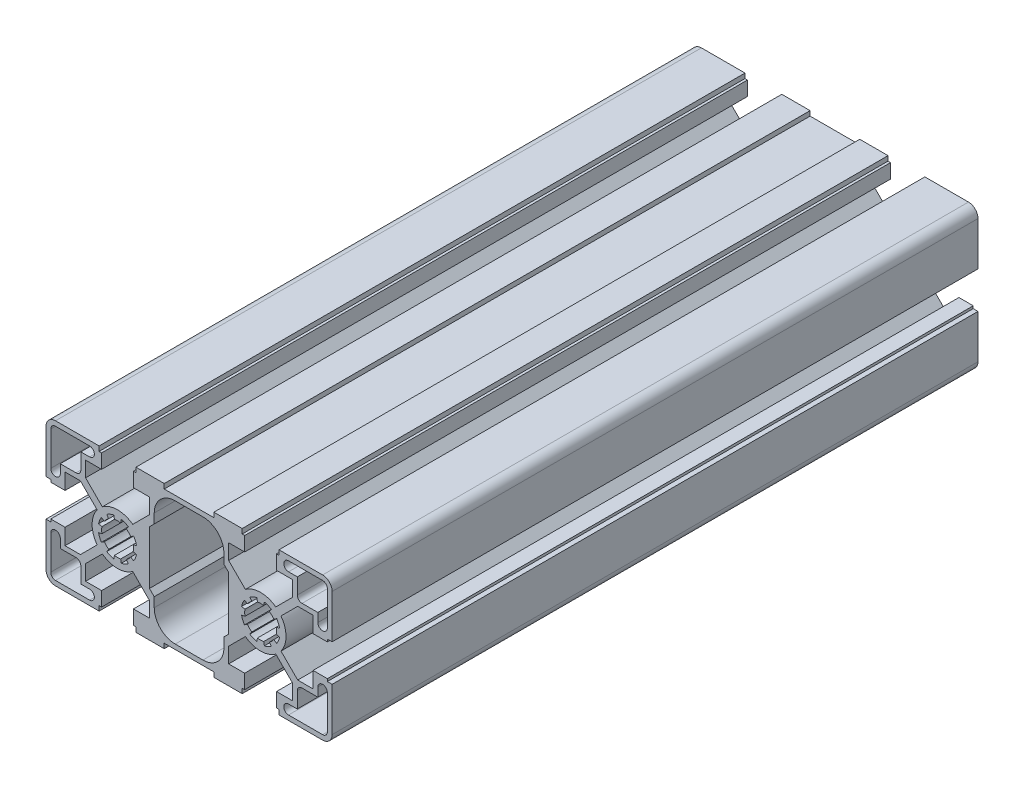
SolidWorks part; units mm, degrees
ref_plane "Front Plane" through (0, 0, 0) normal (0, 0, 1) x (1, 0, 0)
ref_plane "Top Plane" through (0, 0, 0) normal (0, 1, 0) x (1, 0, 0)
ref_plane "Right Plane" through (0, 0, 0) normal (1, 0, 0) x (0, 0, -1)
sketch "Sketch1" plane through (0, 0, 0) normal (0, 0, 1) x (1, 0, 0)
  line L0 (-27.5082, 0) -> (-17.5006, 0) construction
  line L1 (17.5006, 0) -> (27.5082, 0) construction
  line L2 (-42.0116, 22.5044) -> (-28.2956, 22.5044)
  line L3 (-28.2956, 22.5044) -> (-28.2956, 21.0058)
  line L4 (-28.2956, 21.0058) -> (-27.5082, 21.0058)
  line L5 (22.5044, -5.0038) -> (22.5044, 5.0038) construction
  line L6 (-27.5082, 21.0058) -> (-27.5082, 16.51)
  line L7 (-27.5082, 16.51) -> (-32.5501, 16.51)
  line L8 (-32.5501, 16.51) -> (-32.5501, 11.6801)
  line L9 (-32.5501, 11.6801) -> (-27.2854, 6.4154)
  line L11 (-34.1845, 10.0457) -> (-28.9198, 4.781)
  line L12 (-39.0144, 10.0457) -> (-34.1845, 10.0457)
  line L13 (-39.0144, 5.0038) -> (-39.0144, 10.0457)
  line L14 (-43.5102, 5.0038) -> (-39.0144, 5.0038)
  line L15 (-43.5102, 5.7912) -> (-43.5102, 5.0038)
  line L16 (-45.0088, 5.7912) -> (-43.5102, 5.7912)
  line L17 (-45.0088, 19.5072) -> (-45.0088, 5.7912)
  line L18 (-40.513, 11.5443) -> (-35.5473, 11.5443)
  line L19 (-40.513, 11.5443) -> (-40.513, 8.7884)
  line L20 (-34.0487, 18.0086) -> (-34.0487, 13.0429)
  line L21 (-43.5102, 19.5072) -> (-43.5102, 8.7884)
  line L23 (-34.0487, 18.0086) -> (-31.2928, 18.0086)
  line L24 (-42.0116, 21.0058) -> (-31.2928, 21.0058)
  line L25 (-21.3151, 5.9789) -> (-21.5282, 4.9077)
  line L26 (-23.6937, 5.9789) -> (-23.4806, 4.9077)
  line L27 (-17.4358, 3.3868) -> (-18.3439, 2.78)
  line L28 (-19.1176, 5.0686) -> (-19.7244, 4.1605)
  line L29 (-16.5255, -1.1893) -> (-17.5967, -0.9762)
  line L30 (-16.5255, 1.1893) -> (-17.5967, 0.9762)
  line L31 (-19.1176, -5.0686) -> (-19.7244, -4.1605)
  line L32 (-17.4358, -3.3868) -> (-18.3439, -2.78)
  line L33 (-23.6937, -5.9789) -> (-23.4806, -4.9077)
  line L34 (-21.3151, -5.9789) -> (-21.5282, -4.9077)
  line L35 (-27.573, -3.3868) -> (-26.6649, -2.78)
  line L36 (-25.8912, -5.0686) -> (-25.2844, -4.1605)
  line L37 (-28.4833, 1.1893) -> (-27.4121, 0.9762)
  line L38 (-28.4833, -1.1893) -> (-27.4121, -0.9762)
  line L39 (-25.8912, 5.0686) -> (-25.2844, 4.1605)
  line L40 (-27.573, 3.3868) -> (-26.6649, 2.78)
  line L41 (-7.8105, 22.5044) -> (-7.8105, 21.0058)
  line L42 (-7.8105, 21.0058) -> (7.8105, 21.0058)
  line L43 (-7.8105, 22.5044) -> (-16.7132, 22.5044)
  line L44 (-16.7132, 22.5044) -> (-16.7132, 21.0058)
  line L45 (-16.7132, 21.0058) -> (-17.5006, 21.0058)
  line L46 (-17.5006, 21.0058) -> (-17.5006, 16.51)
  line L47 (-17.5006, 16.51) -> (-12.4587, 16.51)
  line L48 (-12.4587, 16.51) -> (-12.4587, 11.6801)
  line L49 (-12.4587, 11.6801) -> (-17.7234, 6.4154)
  line L50 (-10.9601, 9.9099) -> (-12.4587, 8.4113)
  line L51 (7.8105, 21.0058) -> (7.8105, 22.5044)
  line L53 (-7.8105, -22.5044) -> (-16.7132, -22.5044)
  line L54 (7.8105, -22.5044) -> (16.7132, -22.5044)
  line L55 (7.8105, -21.0058) -> (7.8105, -22.5044)
  line L56 (-7.8105, -21.0058) -> (7.8105, -21.0058)
  line L57 (-7.8105, -22.5044) -> (-7.8105, -21.0058)
  line L58 (-40.513, -11.5443) -> (-35.5473, -11.5443)
  line L59 (4.3561, 19.5072) -> (-4.3561, 19.5072)
  line L60 (-10.9601, 12.9032) -> (-10.9601, 9.9099)
  line L61 (-12.4587, -8.4113) -> (-10.9601, -9.9099)
  line L62 (-12.4587, 8.4113) -> (-12.4587, -8.4113)
  line L63 (-10.9601, -12.9032) -> (-10.9601, -9.9099)
  line L64 (4.3561, -19.5072) -> (-4.3561, -19.5072)
  line L65 (10.9601, 12.9032) -> (10.9601, 9.9099)
  line L66 (10.9601, -12.9032) -> (10.9601, -9.9099)
  line L67 (12.4587, 8.4113) -> (12.4587, -8.4113)
  line L68 (10.9601, -9.9099) -> (12.4587, -8.4113)
  line L69 (10.9601, 9.9099) -> (12.4587, 8.4113)
  line L70 (-12.4587, -11.6801) -> (-17.7234, -6.4154)
  line L71 (-12.4587, -16.51) -> (-12.4587, -11.6801)
  line L72 (-17.5006, -16.51) -> (-12.4587, -16.51)
  line L73 (-17.5006, -21.0058) -> (-17.5006, -16.51)
  line L74 (-16.7132, -21.0058) -> (-17.5006, -21.0058)
  line L75 (-16.7132, -22.5044) -> (-16.7132, -21.0058)
  line L76 (-34.0487, -18.0086) -> (-31.2928, -18.0086)
  line L77 (-42.0116, -21.0058) -> (-31.2928, -21.0058)
  line L78 (-42.0116, -22.5044) -> (-28.2956, -22.5044)
  line L79 (-28.2956, -22.5044) -> (-28.2956, -21.0058)
  line L80 (-28.2956, -21.0058) -> (-27.5082, -21.0058)
  line L81 (-27.5082, -21.0058) -> (-27.5082, -16.51)
  line L82 (-27.5082, -16.51) -> (-32.5501, -16.51)
  line L83 (-32.5501, -16.51) -> (-32.5501, -11.6801)
  line L84 (-32.5501, -11.6801) -> (-27.2854, -6.4154)
  line L85 (-34.1845, -10.0457) -> (-28.9198, -4.781)
  line L86 (-43.5102, -19.5072) -> (-43.5102, -8.7884)
  line L87 (-34.0487, -18.0086) -> (-34.0487, -13.0429)
  line L88 (-40.513, -11.5443) -> (-40.513, -8.7884)
  line L89 (-45.0088, -19.5072) -> (-45.0088, -5.7912)
  line L90 (-45.0088, -5.7912) -> (-43.5102, -5.7912)
  line L91 (-43.5102, -5.7912) -> (-43.5102, -5.0038)
  line L92 (-43.5102, -5.0038) -> (-39.0144, -5.0038)
  line L93 (-39.0144, -5.0038) -> (-39.0144, -10.0457)
  line L94 (-39.0144, -10.0457) -> (-34.1845, -10.0457)
  line L96 (42.0116, 21.0058) -> (31.2928, 21.0058)
  line L97 (42.0116, 22.5044) -> (28.2956, 22.5044)
  line L98 (34.0487, 18.0086) -> (31.2928, 18.0086)
  line L99 (27.5082, 21.0058) -> (27.5082, 16.51)
  line L100 (28.2956, 21.0058) -> (27.5082, 21.0058)
  line L101 (28.2956, 22.5044) -> (28.2956, 21.0058)
  line L102 (17.5006, 21.0058) -> (17.5006, 16.51)
  line L103 (16.7132, 21.0058) -> (17.5006, 21.0058)
  line L104 (16.7132, 22.5044) -> (16.7132, 21.0058)
  line L105 (7.8105, 22.5044) -> (16.7132, 22.5044)
  line L106 (39.0144, -10.0457) -> (34.1845, -10.0457)
  line L107 (39.0144, -5.0038) -> (39.0144, -10.0457)
  line L108 (43.5102, -5.0038) -> (39.0144, -5.0038)
  line L109 (43.5102, -5.7912) -> (43.5102, -5.0038)
  line L110 (45.0088, -5.7912) -> (43.5102, -5.7912)
  line L111 (45.0088, -19.5072) -> (45.0088, -5.7912)
  line L112 (40.513, -11.5443) -> (35.5473, -11.5443)
  line L113 (40.513, -11.5443) -> (40.513, -8.7884)
  line L114 (34.0487, -18.0086) -> (34.0487, -13.0429)
  line L115 (43.5102, -19.5072) -> (43.5102, -8.7884)
  line L116 (34.1845, -10.0457) -> (28.9198, -4.781)
  line L117 (32.5501, -11.6801) -> (27.2854, -6.4154)
  line L118 (32.5501, -16.51) -> (32.5501, -11.6801)
  line L119 (27.5082, -16.51) -> (32.5501, -16.51)
  line L120 (27.5082, -21.0058) -> (27.5082, -16.51)
  line L121 (28.2956, -21.0058) -> (27.5082, -21.0058)
  line L122 (28.2956, -22.5044) -> (28.2956, -21.0058)
  line L123 (42.0116, -22.5044) -> (28.2956, -22.5044)
  line L124 (42.0116, -21.0058) -> (31.2928, -21.0058)
  line L125 (34.0487, -18.0086) -> (31.2928, -18.0086)
  line L126 (16.7132, -22.5044) -> (16.7132, -21.0058)
  line L127 (16.7132, -21.0058) -> (17.5006, -21.0058)
  line L128 (17.5006, -21.0058) -> (17.5006, -16.51)
  line L129 (17.5006, -16.51) -> (12.4587, -16.51)
  line L130 (12.4587, -16.51) -> (12.4587, -11.6801)
  line L131 (12.4587, -11.6801) -> (17.7234, -6.4154)
  line L132 (12.4587, 11.6801) -> (17.7234, 6.4154)
  line L133 (12.4587, 16.51) -> (12.4587, 11.6801)
  line L134 (27.573, 3.3868) -> (26.6649, 2.78)
  line L135 (25.8912, 5.0686) -> (25.2844, 4.1605)
  line L136 (28.4833, -1.1893) -> (27.4121, -0.9762)
  line L137 (28.4833, 1.1893) -> (27.4121, 0.9762)
  line L138 (25.8912, -5.0686) -> (25.2844, -4.1605)
  line L139 (27.573, -3.3868) -> (26.6649, -2.78)
  line L140 (21.3151, -5.9789) -> (21.5282, -4.9077)
  line L141 (23.6937, -5.9789) -> (23.4806, -4.9077)
  line L142 (17.4358, -3.3868) -> (18.3439, -2.78)
  line L143 (19.1176, -5.0686) -> (19.7244, -4.1605)
  line L144 (16.5255, 1.1893) -> (17.5967, 0.9762)
  line L145 (16.5255, -1.1893) -> (17.5967, -0.9762)
  line L146 (19.1176, 5.0686) -> (19.7244, 4.1605)
  line L147 (17.4358, 3.3868) -> (18.3439, 2.78)
  line L148 (23.6937, 5.9789) -> (23.4806, 4.9077)
  line L149 (21.3151, 5.9789) -> (21.5282, 4.9077)
  line L150 (43.5102, 19.5072) -> (43.5102, 8.7884)
  line L151 (34.0487, 18.0086) -> (34.0487, 13.0429)
  line L152 (40.513, 11.5443) -> (40.513, 8.7884)
  line L153 (40.513, 11.5443) -> (35.5473, 11.5443)
  line L154 (45.0088, 19.5072) -> (45.0088, 5.7912)
  line L155 (45.0088, 5.7912) -> (43.5102, 5.7912)
  line L156 (43.5102, 5.7912) -> (43.5102, 5.0038)
  line L157 (43.5102, 5.0038) -> (39.0144, 5.0038)
  line L158 (39.0144, 5.0038) -> (39.0144, 10.0457)
  line L159 (39.0144, 10.0457) -> (34.1845, 10.0457)
  line L160 (34.1845, 10.0457) -> (28.9198, 4.781)
  line L161 (32.5501, 11.6801) -> (27.2854, 6.4154)
  line L162 (32.5501, 16.51) -> (32.5501, 11.6801)
  line L163 (12.4587, 16.51) -> (17.5006, 16.51)
  line L164 (27.5082, 16.51) -> (32.5501, 16.51)
  arc A0 (-45.0088, 19.5072) -> (-42.0116, 22.5044) centre (-42.0116, 19.5072) cw
  arc A1 (-43.5102, 8.7884) -> (-40.513, 8.7884) centre (-42.0116, 8.7884) ccw
  arc A2 (-43.5102, 19.5072) -> (-42.0116, 21.0058) centre (-42.0116, 19.5072) cw
  arc A3 (-31.2928, 21.0058) -> (-31.2928, 18.0086) centre (-31.2928, 19.5072) cw
  arc A4 (-34.0487, 13.0429) -> (-35.5473, 11.5443) centre (-35.5473, 13.0429) cw
  arc A6 (-21.5282, 4.9077) -> (-23.4806, 4.9077) centre (-22.5044, 0) ccw
  arc A7 (-27.573, 3.3868) -> (-28.4833, 1.1893) centre (-22.5044, 0) ccw
  arc A8 (-18.3439, 2.78) -> (-19.7244, 4.1605) centre (-22.5044, 0) ccw
  arc A9 (-17.5967, -0.9762) -> (-17.5967, 0.9762) centre (-22.5044, 0) ccw
  arc A10 (-19.7244, -4.1605) -> (-18.3439, -2.78) centre (-22.5044, 0) ccw
  arc A11 (-23.4806, -4.9077) -> (-21.5282, -4.9077) centre (-22.5044, 0) ccw
  arc A12 (-26.6649, -2.78) -> (-25.2844, -4.1605) centre (-22.5044, 0) ccw
  arc A13 (-27.4121, 0.9762) -> (-27.4121, -0.9762) centre (-22.5044, 0) ccw
  arc A14 (-25.2844, 4.1605) -> (-26.6649, 2.78) centre (-22.5044, 0) ccw
  arc A15 (-28.4833, -1.1893) -> (-27.573, -3.3868) centre (-22.5044, 0) ccw
  arc A16 (-25.8912, -5.0686) -> (-23.6937, -5.9789) centre (-22.5044, 0) ccw
  arc A17 (-21.3151, -5.9789) -> (-19.1176, -5.0686) centre (-22.5044, 0) ccw
  arc A18 (-17.4358, -3.3868) -> (-16.5255, -1.1893) centre (-22.5044, 0) ccw
  arc A19 (-16.5255, 1.1893) -> (-17.4358, 3.3868) centre (-22.5044, 0) ccw
  arc A20 (-19.1176, 5.0686) -> (-21.3151, 5.9789) centre (-22.5044, 0) ccw
  arc A21 (-23.6937, 5.9789) -> (-25.8912, 5.0686) centre (-22.5044, 0) ccw
  arc A22 (-34.0487, -13.0429) -> (-35.5473, -11.5443) centre (-35.5473, -13.0429) ccw
  arc A23 (-4.3561, 19.5072) -> (-10.9601, 12.9032) centre (-4.3561, 12.9032) ccw
  arc A24 (-4.3561, -19.5072) -> (-10.9601, -12.9032) centre (-4.3561, -12.9032) cw
  arc A25 (4.3561, 19.5072) -> (10.9601, 12.9032) centre (4.3561, 12.9032) cw
  arc A26 (4.3561, -19.5072) -> (10.9601, -12.9032) centre (4.3561, -12.9032) ccw
  arc A27 (-31.2928, -21.0058) -> (-31.2928, -18.0086) centre (-31.2928, -19.5072) ccw
  arc A28 (-43.5102, -19.5072) -> (-42.0116, -21.0058) centre (-42.0116, -19.5072) ccw
  arc A29 (-45.0088, -19.5072) -> (-42.0116, -22.5044) centre (-42.0116, -19.5072) ccw
  arc A30 (-43.5102, -8.7884) -> (-40.513, -8.7884) centre (-42.0116, -8.7884) cw
  arc A31 (-17.7234, 6.4154) -> (-27.2854, 6.4154) centre (-22.5044, 0) ccw
  arc A32 (-27.2854, -6.4154) -> (-17.7234, -6.4154) centre (-22.5044, 0) ccw
  arc A33 (-28.9198, 4.781) -> (-28.9198, -4.781) centre (-22.5044, 0) ccw
  arc A34 (45.0088, 19.5072) -> (42.0116, 22.5044) centre (42.0116, 19.5072) ccw
  arc A35 (43.5102, 19.5072) -> (42.0116, 21.0058) centre (42.0116, 19.5072) ccw
  arc A36 (31.2928, 21.0058) -> (31.2928, 18.0086) centre (31.2928, 19.5072) ccw
  arc A37 (28.9198, 4.781) -> (28.9198, -4.781) centre (22.5044, 0) cw
  arc A38 (27.2854, -6.4154) -> (17.7234, -6.4154) centre (22.5044, 0) cw
  arc A39 (17.7234, 6.4154) -> (27.2854, 6.4154) centre (22.5044, 0) cw
  arc A40 (43.5102, -8.7884) -> (40.513, -8.7884) centre (42.0116, -8.7884) ccw
  arc A41 (34.0487, -13.0429) -> (35.5473, -11.5443) centre (35.5473, -13.0429) cw
  arc A42 (45.0088, -19.5072) -> (42.0116, -22.5044) centre (42.0116, -19.5072) cw
  arc A43 (43.5102, -19.5072) -> (42.0116, -21.0058) centre (42.0116, -19.5072) cw
  arc A44 (31.2928, -21.0058) -> (31.2928, -18.0086) centre (31.2928, -19.5072) cw
  arc A45 (23.6937, 5.9789) -> (25.8912, 5.0686) centre (22.5044, 0) cw
  arc A46 (19.1176, 5.0686) -> (21.3151, 5.9789) centre (22.5044, 0) cw
  arc A47 (16.5255, 1.1893) -> (17.4358, 3.3868) centre (22.5044, 0) cw
  arc A48 (17.4358, -3.3868) -> (16.5255, -1.1893) centre (22.5044, 0) cw
  arc A49 (21.3151, -5.9789) -> (19.1176, -5.0686) centre (22.5044, 0) cw
  arc A50 (25.8912, -5.0686) -> (23.6937, -5.9789) centre (22.5044, 0) cw
  arc A51 (28.4833, -1.1893) -> (27.573, -3.3868) centre (22.5044, 0) cw
  arc A52 (25.2844, 4.1605) -> (26.6649, 2.78) centre (22.5044, 0) cw
  arc A53 (27.4121, 0.9762) -> (27.4121, -0.9762) centre (22.5044, 0) cw
  arc A54 (26.6649, -2.78) -> (25.2844, -4.1605) centre (22.5044, 0) cw
  arc A55 (23.4806, -4.9077) -> (21.5282, -4.9077) centre (22.5044, 0) cw
  arc A56 (19.7244, -4.1605) -> (18.3439, -2.78) centre (22.5044, 0) cw
  arc A57 (17.5967, -0.9762) -> (17.5967, 0.9762) centre (22.5044, 0) cw
  arc A58 (18.3439, 2.78) -> (19.7244, 4.1605) centre (22.5044, 0) cw
  arc A59 (27.573, 3.3868) -> (28.4833, 1.1893) centre (22.5044, 0) cw
  arc A60 (21.5282, 4.9077) -> (23.4806, 4.9077) centre (22.5044, 0) cw
  arc A62 (34.0487, 13.0429) -> (35.5473, 11.5443) centre (35.5473, 13.0429) ccw
  arc A63 (43.5102, 8.7884) -> (40.513, 8.7884) centre (42.0116, 8.7884) cw
extrude "Boss-Extrude1" add sketch "Sketch1" along normal mid plane 203.2
